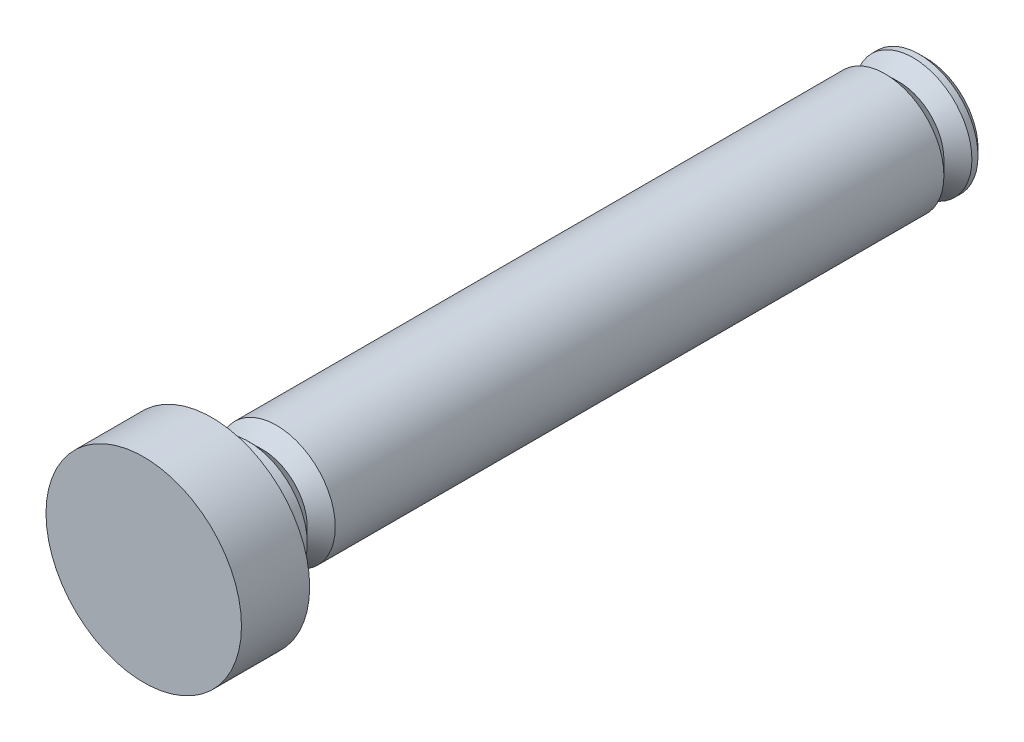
SolidWorks part; units mm, degrees
ref_plane "Front Plane" through (0, 0, 0) normal (0, 0, 1) x (1, 0, 0)
ref_plane "Top Plane" through (0, 0, 0) normal (0, 1, 0) x (1, 0, 0)
ref_plane "Right Plane" through (0, 0, 0) normal (1, 0, 0) x (0, 0, -1)
sketch "Sketch1" plane through (0, 0, 0) normal (1, 0, 0) x (0, 0, -1)
  line L0 (0, 0) -> (32.639, 0)
  line L1 (0, 0) -> (0, 4.0767)
  line L2 (0, 4.0767) -> (2.8448, 4.0767)
  line L3 (2.8448, 4.0767) -> (2.8448, 2.4511)
  line L4 (2.8448, 2.4511) -> (4.3688, 2.4511)
  line L5 (4.3688, 2.4511) -> (4.953, 1.8669)
  line L6 (4.953, 1.8669) -> (5.5372, 2.4511)
  line L7 (5.5372, 2.4511) -> (30.9245, 2.4511)
  line L8 (30.9245, 2.4511) -> (31.5087, 1.8669)
  line L9 (31.5087, 1.8669) -> (32.0929, 2.4511)
  line L10 (32.0929, 2.4511) -> (32.3469, 2.4511)
  line L11 (32.3469, 2.4511) -> (32.639, 2.159)
  line L12 (32.639, 2.159) -> (32.639, 0)
  dimension "D1" = 32.639
  dimension "D2" = 4.0767
  dimension "D3" = 2.8448
  dimension "D4" = 2.4511
  dimension "D5" = 1.524
  dimension "D6" = 135
  dimension "D7" = 1.8669
  dimension "D8" = 1.8669
  dimension "D9" = 0.254
  dimension "D10" = 2.159
revolve "Revolve1" add sketch "Sketch1" angle 360 about L0
